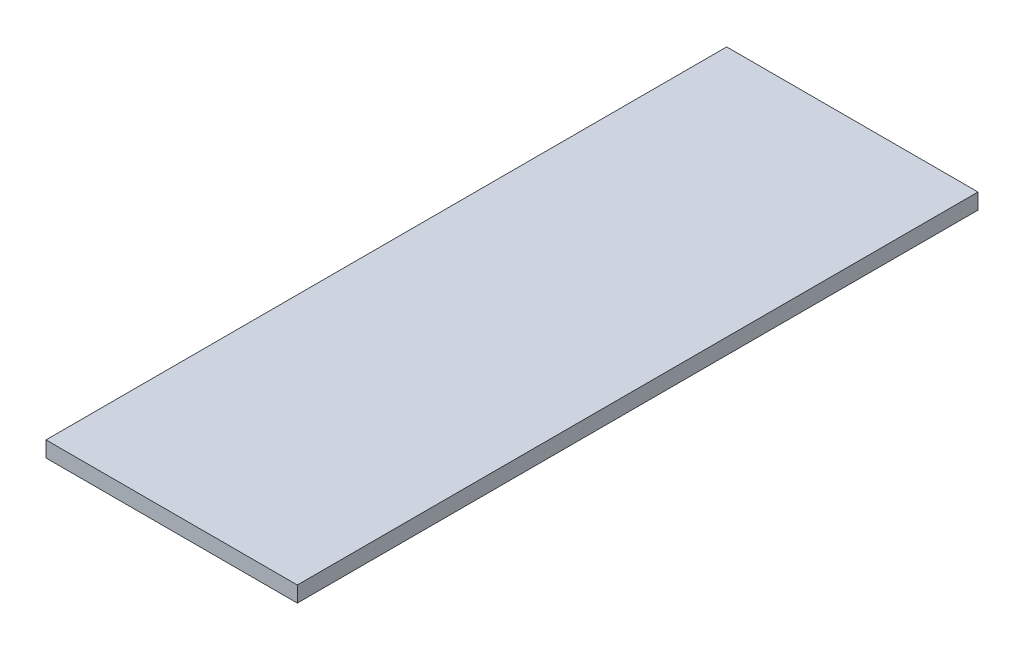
SolidWorks part; units mm, degrees
ref_plane "Plan de face" through (0, 0, 0) normal (0, 0, 1) x (1, 0, 0)
ref_plane "Plan de dessus" through (0, 0, 0) normal (0, 1, 0) x (1, 0, 0)
ref_plane "Plan de droite" through (0, 0, 0) normal (1, 0, 0) x (0, 0, -1)
sketch "Esquisse1" plane through (0, 0, 0) normal (0, 0, 1) x (1, 0, 0)
  line L1 (-24, 92) -> (24, 92)
  line L2 (-24, 92) -> (-24, 95)
  line L3 (-24, 95) -> (24, 95)
  line L4 (24, 92) -> (24, 95)
extrude "Boss.-Extru.1" add sketch "Esquisse1" along normal up to surface (10 mm away) and the other way up to surface (120 mm away)
